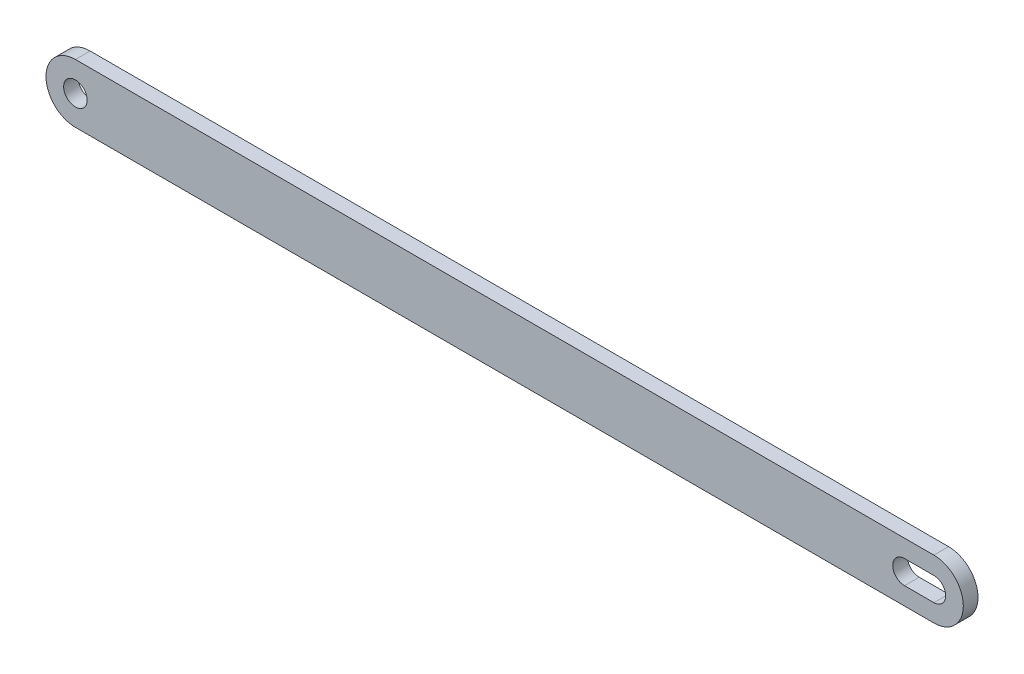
SolidWorks part; units mm, degrees
ref_plane "Front Plane" through (0, 0, 0) normal (0, 0, 1) x (1, 0, 0)
ref_plane "Top Plane" through (0, 0, 0) normal (0, 1, 0) x (1, 0, 0)
ref_plane "Right Plane" through (0, 0, 0) normal (1, 0, 0) x (0, 0, -1)
sketch "Sketch1" plane through (0, 0, 0) normal (0, 0, 1) x (1, 0, 0)
  line L0 (-73, 0) -> (73, 0) construction
  line L1 (-73, -5) -> (73, -5)
  line L2 (-73, 5) -> (73, 5)
  arc A0 (-73, -5) -> (-73, 5) centre (-73, 0) cw
  arc A1 (73, -5) -> (73, 5) centre (73, 0) ccw
  dimension "D2" = 156
  dimension "D1" = 10
sheet metal parameters "Sheet-Metal1" thickness 2.5 parameters "D1"=0
base flange "Base-Flange1" sketch "Sketch1" thickness 2.5 reverse thickness direction yes parameters "D1"=0
sketch "Sketch3" plane through (0, 0, 2.5) normal (0, 0, 1) x (1, 0, 0)
  circle A0 centre (-73, 0) radius 2
  dimension "D1" = 4
extrude "Extrude1" cut sketch "Sketch3" against normal through all
sketch "Sketch4" plane through (0, 0, 2.5) normal (0, 0, 1) x (1, 0, 0)
  line L0 (73, 0) -> (68, 0) construction
  line L1 (-73, 0) -> (73, 0) construction
  line L2 (73, 2) -> (68, 2)
  line L3 (73, -2) -> (68, -2)
  arc A0 (73, 2) -> (73, -2) centre (73, 0) cw
  arc A1 (68, 2) -> (68, -2) centre (68, 0) ccw
  dimension "D1" = 4
  dimension "D2" = 5
extrude "Extrude2" cut sketch "Sketch4" against normal through all
flat pattern "Flat-Pattern1"
sketch "Bend-Lines1" plane through (0, 0, 0) normal (0, 1, 0) x (-1, 0, 0)
